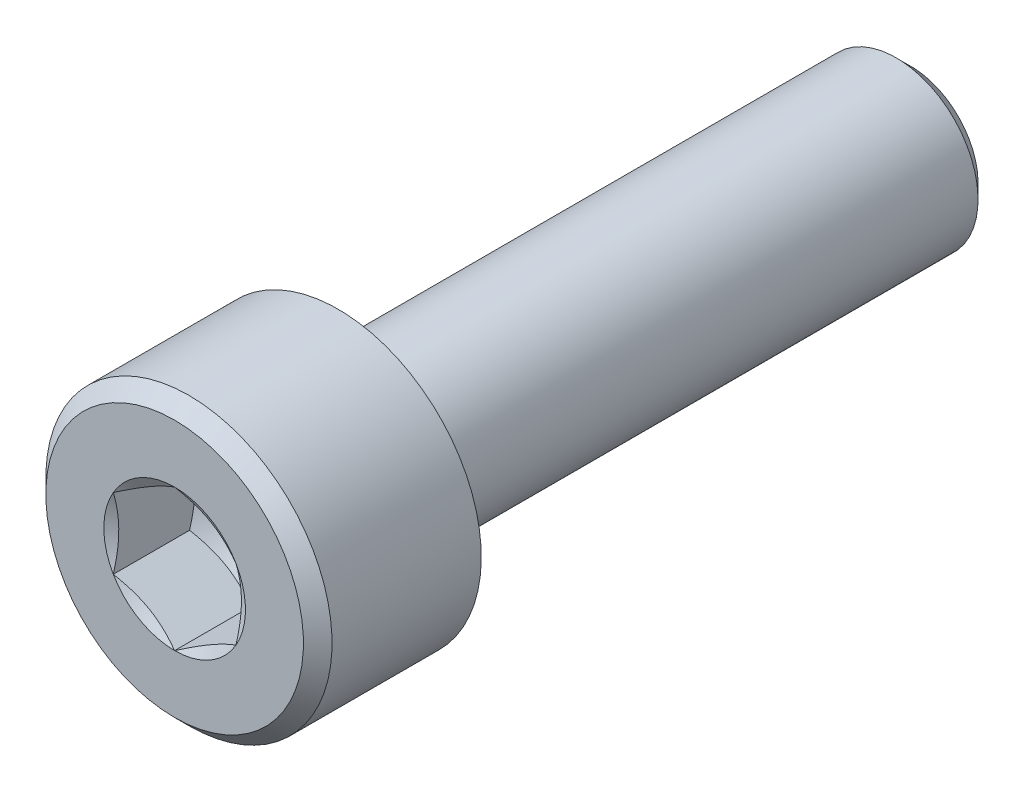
SolidWorks part; units mm, degrees
ref_plane "Front" through (0, 0, 0) normal (0, 0, 1) x (1, 0, 0)
ref_plane "Top" through (0, 0, 0) normal (0, 1, 0) x (1, 0, 0)
ref_plane "Right" through (0, 0, 0) normal (1, 0, 0) x (0, 0, -1)
sketch "Sketch1" plane through (0, 0, 0) normal (1, 0, 0) x (0, 0, -1)
  line L0 (0, 3.5) -> (-4, 3.5)
  line L1 (-4, 3.5) -> (-4, 0)
  line L2 (-4, 0) -> (14, 0)
  line L3 (14, 0) -> (14, 2)
  line L4 (14, 2) -> (0, 2)
  line L5 (0, 2) -> (0, 3.5)
  line L6 (0, 0) -> (12.7561, 0) construction
  dimension "l" = 14
  dimension "d" = 4
  dimension "k" = 4
  dimension "dk" = 7
revolve "Revolve1" add sketch "Sketch1" angle 360 about L2
sketch "Sketch7" plane through (0, 0, 0) normal (1, 0, 0) x (0, 0, -1)
  line L0 (-6.6396, 0) -> (3.6195, 0) construction
  line L1 (-4, 0) -> (-4, 1.5)
  line L2 (-4, 3.5) -> (-4, -3.5) construction
  line L3 (-4, 1.5) -> (-2, 1.5)
  line L4 (-2, 1.5) -> (-1.134, 0)
  line L6 (-4, 0) -> (-1.134, 0)
  dimension "D1" = 60
  dimension "S" = 3
  dimension "t" = 2
revolve "Cut-Revolve2" cut sketch "Sketch7" angle 360 about L6
chamfer "Chamfer1" distance 0.35 2 edges at (0, -2, -14) (0, -3.5, 4)
sketch "Sketch8" plane through (0, 0, 4) normal (0, 0, 1) x (1, 0, 0)
  line L1 (0, 1.7321) -> (-1.5, 0.866)
  line L2 (-1.5, 0.866) -> (-1.5, -0.866)
  line L3 (-1.5, -0.866) -> (0, -1.7321)
  line L4 (0, -1.7321) -> (1.5, -0.866)
  line L5 (1.5, -0.866) -> (1.5, 0.866)
  line L6 (1.5, 0.866) -> (0, 1.7321)
  circle A0 centre (0, 0) radius 1.5 construction
  circle A1 centre (0, 0) radius 1.5 construction
extrude "Cut-Extrude1" cut sketch "Sketch8" against normal up to surface (1.866 mm away)
sketch "Sketch9" plane through (0, 0, 0) normal (1, 0, 0) x (0, 0, -1)
  line L0 (-4, 1.5) -> (4.2695, 1.5) construction
  line L3 (-4.5, 2.5981) -> (-4.5, 1.5)
  line L4 (-4.5, 1.5) -> (-3.866, 1.5)
  line L5 (-3.866, 1.5) -> (-4.5, 2.5981)
  line L6 (-4, 3.5) -> (-4, -3.5) construction
  dimension "D1" = 60
  dimension "D2" = 0.5
revolve "Cut-Revolve3" cut sketch "Sketch9" angle 360 about axis through (0, 0, 4) along (0, 0, -1)
fillet "Fillet2" radius 0.4 1 edges at (0, -2, 0)
